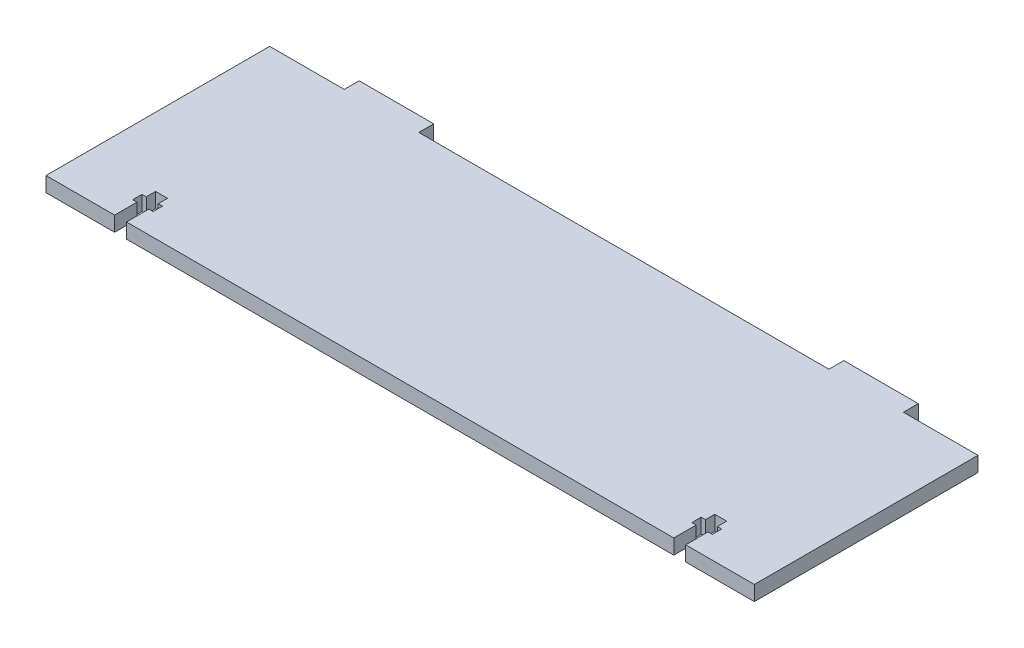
SolidWorks part; units mm, degrees
ref_plane "Ebene vorne" through (0, 0, 0) normal (0, 0, 1) x (1, 0, 0)
ref_plane "Ebene oben" through (0, 0, 0) normal (0, 1, 0) x (1, 0, 0)
ref_plane "Ebene rechts" through (0, 0, 0) normal (1, 0, 0) x (0, 0, -1)
sketch "Skizze1" plane through (0, 0, 0) normal (0, 1, 0) x (1, 0, 0)
  line L0 (-46.5103, 0) -> (56.2677, 0) construction
  line L1 (-95, 30) -> (-75, 30)
  line L2 (-95, 30) -> (-95, -30)
  line L3 (-95, -30) -> (-76.6, -30)
  line L4 (95, 30) -> (95, -30)
  line L5 (0, 48.7268) -> (0, -51.5374) construction
  line L6 (-55, 30) -> (55, 30)
  line L7 (-75, 34) -> (-55, 34)
  line L8 (-75, 34) -> (-75, 30)
  line L9 (75, 34) -> (75, 30)
  line L10 (-55, 34) -> (-55, 30)
  line L11 (55, 34) -> (55, 30)
  line L12 (75, 34) -> (55, 34)
  line L13 (75, 30) -> (95, 30)
  line L14 (-75, -19) -> (-75, -32.8566) construction
  line L15 (-76.6, -19) -> (-73.4, -19)
  line L16 (-76.6, -19) -> (-76.6, -21.5)
  line L18 (-73.4, -19) -> (-73.4, -21.5)
  line L19 (-77.75, -21.5) -> (-76.6, -21.5)
  line L20 (-77.75, -21.5) -> (-77.75, -24)
  line L21 (-77.75, -24) -> (-76.6, -24)
  line L22 (-72.25, -21.5) -> (-72.25, -24)
  line L23 (-73.4, -21.5) -> (-72.25, -21.5)
  line L24 (-76.6, -24) -> (-76.6, -30)
  line L25 (-73.4, -24) -> (-72.25, -24)
  line L26 (-73.4, -30) -> (73.4, -30)
  line L27 (-73.4, -24) -> (-73.4, -30)
  line L28 (76.6, -24) -> (76.6, -30)
  line L29 (73.4, -24) -> (73.4, -30)
  line L30 (73.4, -24) -> (72.25, -24)
  line L31 (73.4, -21.5) -> (72.25, -21.5)
  line L32 (72.25, -21.5) -> (72.25, -24)
  line L33 (77.75, -24) -> (76.6, -24)
  line L34 (77.75, -21.5) -> (77.75, -24)
  line L35 (77.75, -21.5) -> (76.6, -21.5)
  line L36 (73.4, -19) -> (73.4, -21.5)
  line L37 (76.6, -19) -> (76.6, -21.5)
  line L38 (76.6, -19) -> (73.4, -19)
  line L39 (76.6, -30) -> (95, -30)
  dimension "D1" = 60
  dimension "D2" = 190
  dimension "D3" = 20
  dimension "D4" = 20
  dimension "D5" = 4
  dimension "D6" = 3.2
  dimension "D7" = 5.5
  dimension "D8" = 2.5
  dimension "D9" = 11
  dimension "D10" = 6
  dimension "D11" = 75
extrude "Aufsatz-Linear austragen1" add sketch "Skizze1" along normal blind 4
